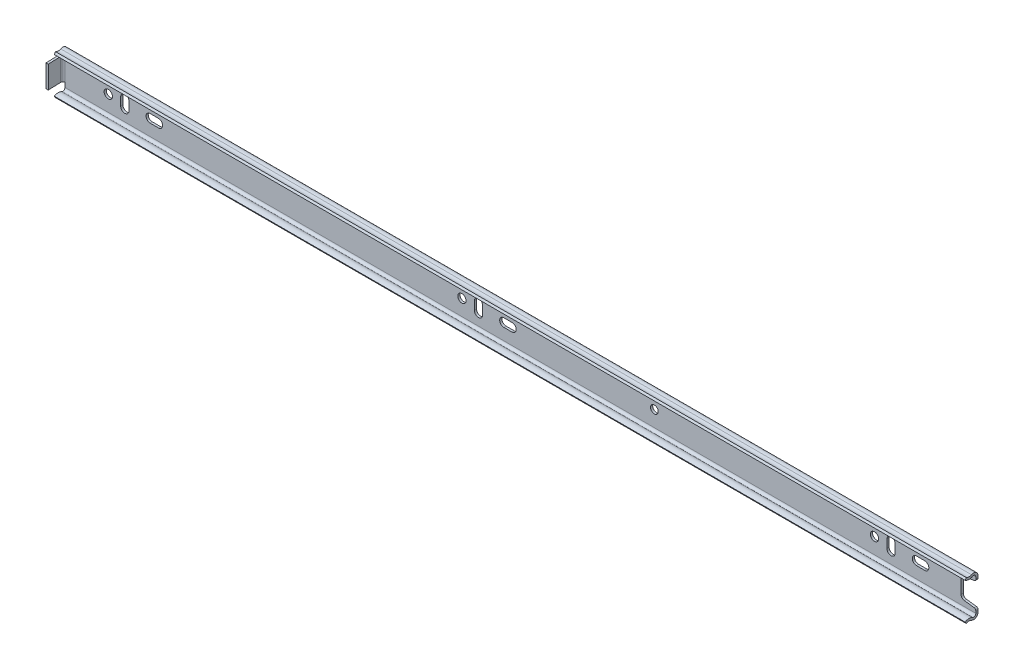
SolidWorks part; units mm, degrees
ref_plane "Front Plane" through (0, 0, 0) normal (0, 0, 1) x (1, 0, 0)
ref_plane "Top Plane" through (0, 0, 0) normal (0, 1, 0) x (1, 0, 0)
ref_plane "Right Plane" through (0, 0, 0) normal (1, 0, 0) x (0, 0, -1)
imported_body "Imported3"
sketch "Sketch1" plane through (-247.0993, 0, 0) normal (-1, 0, 0) x (0, 0, 1)
  line L0 (0, 6.1) -> (-0.8535, 6.1) construction
  line L1 (9.799, 12.4883) -> (-5.9464, 12.4883)
  line L2 (9.799, 12.4883) -> (9.799, 6.1)
  line L3 (9.799, 6.1) -> (-5.9464, 6.1)
  line L4 (-5.9464, 12.4883) -> (-5.9464, 6.1)
extrude "Cut-Extrude1" cut sketch "Sketch1" against normal blind 1.0993
sketch "Sketch2" plane through (-247.0993, 0, 0) normal (-1, 0, 0) x (0, 0, 1)
  line L0 (-1.2, -6.1) -> (-1.2, -8.6)
  line L1 (5.1618, -10.8162) -> (5.8, -9.8)
  line L2 (0, -8.6) -> (0, -6.1)
  line L3 (0, -6.1) -> (-1.2, -6.1)
  arc A0 (1.7654, -9.6584) -> (0, -8.6) centre (1.2, -8.6) cw
  spline S0 degree 2 poles (2.3308, -10.7169) (2.0615, -10.8608) (1.7642, -10.9327) (1.4573, -11.007) (1.1406, -10.9993) (0.825, -10.9915) (0.5212, -10.902) (0.2285, -10.8158) (-0.0341, -10.6584) (-0.2958, -10.5016) (-0.5106, -10.2834) (-0.7321, -10.0584) (-0.8883, -9.7828) (-1.044, -9.5081) (-1.1234, -9.2015) (-1.2, -8.9059) (-1.2, -8.6) knots 0 0 0 0.125 0.125 0.25 0.25 0.375 0.375 0.5 0.5 0.625 0.625 0.75 0.75 0.875 0.875 1 1 1
  spline S1 degree 3 poles (2.3308, -10.7169) (2.7397, -10.4985) (3.1964, -10.384) (3.6607, -10.384) knots 0 0 0 0 1 1 1 1
  spline S2 degree 3 poles (3.6607, -10.384) (4.1914, -10.384) (4.7118, -10.5336) (5.1618, -10.8162) knots 0 0 0 0 1 1 1 1
  spline S3 degree 2 poles (3.6607, -9.184) (4.2286, -9.184) (4.7738, -9.341) (5.3195, -9.4983) (5.8, -9.8) knots 0 0 0 0.5 0.5 1 1 1
  spline S4 degree 2 poles (1.7654, -9.6584) (2.203, -9.4247) (2.6838, -9.3044) (3.1651, -9.184) (3.6607, -9.184) knots 0 0 0 0.5 0.5 1 1 1
extrude "Cut-Extrude2" cut sketch "Sketch2" against normal blind 1.0993
sketch "Sketch3" plane through (0, 0, 0) normal (0, 0, 1) x (1, 0, 0)
  line L0 (248.5, 5.4468) -> (240.5, 5.4468)
  line L1 (240.5, 5.4468) -> (240.5, -5.4468)
  line L2 (240.5, -5.4468) -> (248.5, -5.4468)
  line L3 (248.5, -5.4468) -> (248.5, 5.4468)
extrude "Cut-Extrude3" cut sketch "Sketch3" against normal through all
sketch "Sketch4" plane through (0, 0, -1.2) normal (0, 0, -1) x (-1, 0, 0)
  line L0 (215.75, -2.25) -> (215.75, 2.25)
  line L1 (211.25, 2.25) -> (211.25, -2.25)
  arc A0 (215.75, 2.25) -> (211.25, 2.25) centre (213.5, 2.25) ccw
  arc A1 (211.25, -2.25) -> (215.75, -2.25) centre (213.5, -2.25) ccw
extrude "Cut-Extrude4" cut sketch "Sketch4" against normal through all
sketch "Sketch5" plane through (0, 0, -1.2) normal (0, 0, -1) x (-1, 0, 0)
  line L0 (199.75, 2.25) -> (195.25, 2.25)
  line L1 (195.25, -2.25) -> (199.75, -2.25)
  arc A0 (195.25, 2.25) -> (195.25, -2.25) centre (195.25, 0) ccw
  arc A1 (199.75, -2.25) -> (199.75, 2.25) centre (199.75, 0) ccw
extrude "Cut-Extrude5" cut sketch "Sketch5" against normal through all
sketch "Sketch6" plane through (0, 0, -1.2) normal (0, 0, -1) x (-1, 0, 0)
  line L0 (23.75, -2.25) -> (23.75, 2.25)
  line L1 (19.25, 2.25) -> (19.25, -2.25)
  arc A0 (23.75, 2.25) -> (19.25, 2.25) centre (21.5, 2.25) ccw
  arc A1 (19.25, -2.25) -> (23.75, -2.25) centre (21.5, -2.25) ccw
extrude "Cut-Extrude6" cut sketch "Sketch6" against normal through all
sketch "Sketch7" plane through (0, 0, -1.2) normal (0, 0, -1) x (-1, 0, 0)
  line L0 (7.75, 2.25) -> (3.25, 2.25)
  line L1 (3.25, -2.25) -> (7.75, -2.25)
  arc A0 (3.25, 2.25) -> (3.25, -2.25) centre (3.25, 0) ccw
  arc A1 (7.75, -2.25) -> (7.75, 2.25) centre (7.75, 0) ccw
extrude "Cut-Extrude7" cut sketch "Sketch7" against normal through all
sketch "Sketch8" plane through (0, 0, -1.2) normal (0, 0, -1) x (-1, 0, 0)
  line L0 (-200.25, -2.25) -> (-200.25, 2.25)
  line L1 (-204.75, 2.25) -> (-204.75, -2.25)
  arc A0 (-200.25, 2.25) -> (-204.75, 2.25) centre (-202.5, 2.25) ccw
  arc A1 (-204.75, -2.25) -> (-200.25, -2.25) centre (-202.5, -2.25) ccw
extrude "Cut-Extrude8" cut sketch "Sketch8" against normal through all
sketch "Sketch9" plane through (0, 0, 0) normal (0, 0, 1) x (1, 0, 0)
  line L0 (220.75, 2.25) -> (216.25, 2.25)
  line L1 (216.25, -2.25) -> (220.75, -2.25)
  arc A0 (216.25, 2.25) -> (216.25, -2.25) centre (216.25, 0) ccw
  arc A1 (220.75, -2.25) -> (220.75, 2.25) centre (220.75, 0) ccw
extrude "Cut-Extrude9" cut sketch "Sketch9" against normal through all
draft "Draft1" type of draft neutral plane draft angle 2 faces to draft 1 parameters "D1"=2
draft "Draft2" type of draft neutral plane draft angle 7.5 faces to draft 2 parameters "D1"=7.5
hole_wizard "Ø4.2 (4.2) Diameter Hole1" positions "Sketch11" profile "Sketch10" hole size "Ø4.2" standard "ANSI Metric"
sketch "Sketch11" plane through (0, 0, -1.2) normal (0, 0, -1) x (-1, 0, 0)
  point P0 (-74, 0)
sketch "Sketch10" plane through (74, 0, -1.2) normal (1, 0, 0) x (0, 1, 0)
  line L0 (0, 0) -> (0, 9.4943)
  line L1 (0, 9.4943) -> (2.1, 9.4943)
  line L2 (2.1, 9.4943) -> (2.1, 0)
  line L5 (2.1, 0) -> (0, 0)
  line L11 (0, -6.35) -> (0, 107.95) construction
  dimension "Thru Hole Dia." = 4.2
  dimension "Thru Hole Depth" = 9.4943
hole_wizard "Ø4.5 (4.5) Diameter Hole1" positions "Sketch13" profile "Sketch12" hole size "Ø4.5" standard "ANSI Metric"
sketch "Sketch13" plane through (0, 0, -1.2) normal (0, 0, -1) x (-1, 0, 0)
  point P0 (-193.5, 0)
  point P1 (30.5, 0)
  point P2 (222.5, 0)
sketch "Sketch12" plane through (193.5, 0, -1.2) normal (1, 0, 0) x (0, 1, 0)
  line L0 (0, 0) -> (0, 9.4943)
  line L1 (0, 9.4943) -> (2.25, 9.4943)
  line L2 (2.25, 9.4943) -> (2.25, 0)
  line L5 (2.25, 0) -> (0, 0)
  line L11 (0, -6.35) -> (0, 107.95) construction
  dimension "Thru Hole Dia." = 4.5
  dimension "Thru Hole Depth" = 9.4943
fillet "Fillet1" radius 1 2 edges at (248.5, -6.5, -0.6) (248.5, 6.5, -0.6)
fillet "Fillet2" radius 1.2 1 edges at (-247.0993, 0, 0)
fillet "Fillet3" radius 2 2 edges at (240.5, -5.4468, -0.6) (240.5, 5.4468, -0.6)
